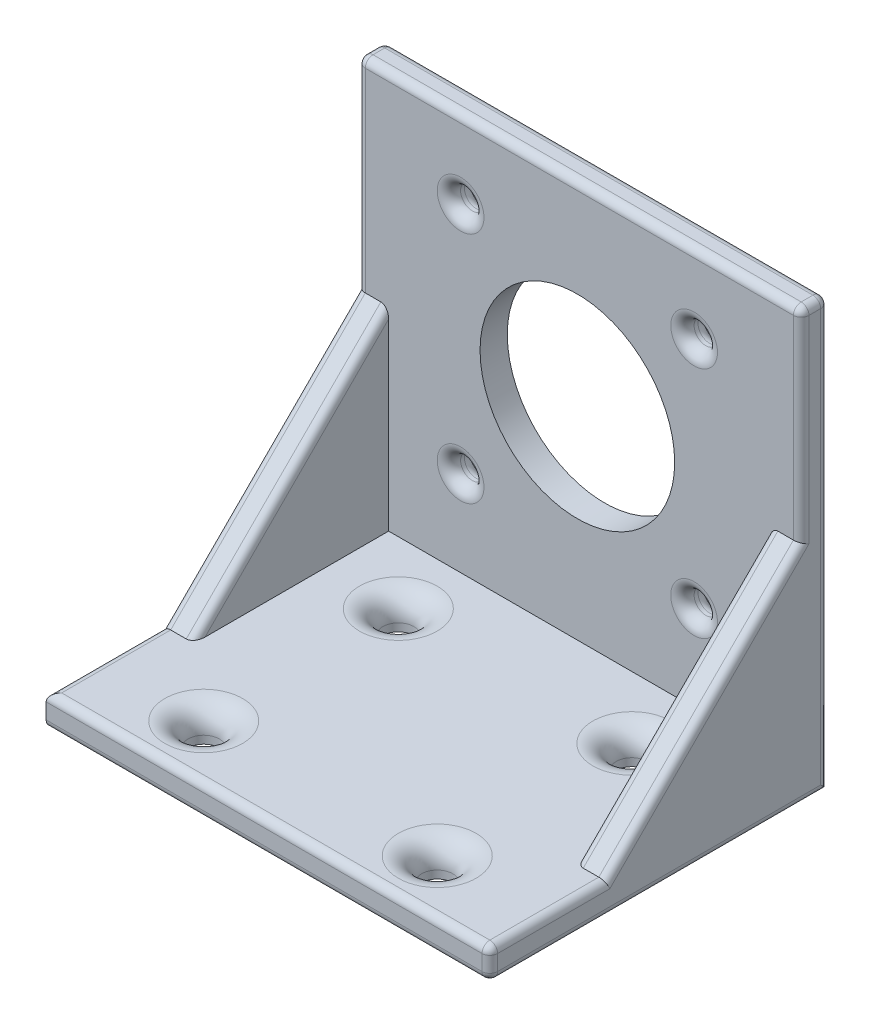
SolidWorks part; units mm, degrees
ref_plane "Front Plane" through (0, 0, 0) normal (0, 0, 1) x (1, 0, 0)
ref_plane "Top Plane" through (0, 0, 0) normal (0, 1, 0) x (1, 0, 0)
ref_plane "Right Plane" through (0, 0, 0) normal (1, 0, 0) x (0, 0, -1)
sketch "Sketch7" plane through (0, 0, 0) normal (0, 0, 1) x (1, 0, 0)
  line L1 (-65.2691, 9.1691) -> (-8.2691, 9.1691)
  line L2 (-65.2691, 9.1691) -> (-65.2691, -45.8309)
  line L3 (-65.2691, -45.8309) -> (-8.2691, -45.8309)
  line L4 (-8.2691, 9.1691) -> (-8.2691, -45.8309)
  circle A0 centre (-37.0244, -15.8309) radius 12.5
  circle A1 centre (-22.0244, -0.8309) radius 1.5
  circle A2 centre (-52.0244, -0.8309) radius 1.5
  circle A3 centre (-22.0244, -30.8309) radius 1.5
  circle A4 centre (-52.0244, -30.8309) radius 1.5
  point P4 (0, 0)
  point P5 (0, 0)
  point P16 (0, 0)
  point P17 (0, 0)
  point P18 (-54.1898, -3.4683)
  point P19 (0, 0)
  point P20 (0, 0)
  point P21 (0, 0)
  point P22 (-22.0244, 0.6691)
  point P23 (0, 0)
  point P24 (0, 0)
  point P25 (0, 0)
  dimension "D3" = 15
  dimension "D6" = 15
  dimension "D7" = 15
  dimension "D8" = 30
  dimension "D9" = 30
  dimension "D10" = 30
  dimension "D11" = 15
  dimension "D1" = 15
  dimension "D2" = 57
  dimension "D4" = 30
  dimension "D5" = 30
  dimension "D12" = 15
  dimension "D13" = 55
extrude "Boss-Extrude5" add sketch "Sketch7" along normal blind 3.5
sketch "Sketch8" plane through (-8.2691, 0, 0) normal (1, 0, 0) x (0, 0, -1)
  line L1 (-3.5, -45.8309) -> (-43.5, -45.8309)
  line L2 (-3.5, -45.8309) -> (-3.5, -41.8309)
  line L3 (-3.5, -41.8309) -> (-43.5, -41.8309)
  line L4 (-43.5, -45.8309) -> (-43.5, -41.8309)
  dimension "D1" = 40
  dimension "D2" = 4
extrude "Boss-Extrude6" add sketch "Sketch8" against normal blind 57
sketch "Sketch9" plane through (-8.2691, 0, 0) normal (1, 0, 0) x (0, 0, -1)
  line L0 (-3.5, -41.8309) -> (-3.5, -16.8309)
  line L2 (-3.5, -41.8309) -> (-3.5, 9.1691) construction
  line L3 (-3.5, -41.8309) -> (-28.5, -41.8309)
  line L4 (-3.5, -41.8309) -> (-43.5, -41.8309) construction
  line L5 (-28.5, -41.8309) -> (-3.5, -16.8309)
  dimension "D1" = 25
  dimension "D2" = 25
extrude "Boss-Extrude7" add sketch "Sketch9" against normal blind 4
sketch "Sketch11" plane through (-65.2691, 0, 0) normal (-1, 0, 0) x (0, 0, 1)
  line L0 (3.5, -16.8309) -> (3.5, -41.8309)
  line L1 (3.5, 9.1691) -> (3.5, -41.8309) construction
  line L2 (3.5, -41.8309) -> (28.5, -41.8309)
  line L3 (28.5, -41.8309) -> (3.5, -16.8309)
  dimension "D1" = 25
  dimension "D2" = 25
extrude "Boss-Extrude8" add sketch "Sketch11" against normal blind 4
sketch "Sketch12" plane through (0, -41.8309, 0) normal (0, 1, 0) x (1, 0, 0)
  line L0 (-36.7691, -43.5) -> (-36.7691, -3.5) construction
  line L1 (-65.2691, -43.5) -> (-8.2691, -43.5) construction
  line L2 (-61.2691, -3.5) -> (-12.2691, -3.5) construction
  circle A0 centre (-52.0244, -36.5) radius 2
  circle A1 centre (-22.0244, -36.5) radius 2
  circle A2 centre (-52.0244, -11.5) radius 2
  circle A3 centre (-22.0244, -11.5) radius 2
  dimension "D3" = 4
  dimension "D4" = 4
  dimension "D5" = 4
  dimension "D6" = 4
  dimension "D1" = 30
  dimension "D2" = 25
extrude "Cut-Extrude4" cut sketch "Sketch12" against normal blind 14
fillet "Fillet1" radius 1 1 edges at (-36.7691, 9.1691, 3.5)
fillet "Fillet2" radius 1 3 edges at (-65.2691, -4.3309, 3.5) (-65.2691, 8.8762, 3.2071) (-65.2691, 9.1691, 1.25)
fillet "Fillet3" radius 1 11 edges at (-8.2691, -4.3309, 3.5) (-8.2691, 8.8762, 3.2071) (-65.2691, -18.8309, 0) (-64.9763, 8.8762, 0) (-8.2691, -43.8309, 43.5) (-8.2691, -45.8309, 21.75) (-8.2691, -41.8309, 36) (-8.2691, -29.3309, 16) (-8.2691, -18.3309, 0) (-8.2691, 9.1691, 1.25) (-36.2691, 9.1691, 0)
fillet "Fillet4" radius 1 7 edges at (-8.562, -45.5381, 43.2071) (-8.562, -42.1238, 43.2071) (-37.2691, -45.8309, 43.5) (-65.2691, -41.8309, 36) (-65.2691, -28.8309, 15.5) (-61.2691, -29.3309, 16) (-37.2691, -41.8309, 43.5)
fillet "Fillet5" radius 1 1 edges at (-12.2691, -29.3309, 16)
fillet "Fillet6" radius 1.5 1 edges at (-50.5244, -0.8309, 3.5)
fillet "Fillet7" radius 1.5 1 edges at (-50.5244, -0.8309, 0)
fillet "Fillet8" radius 1.5 1 edges at (-20.5244, -0.8309, 3.5)
fillet "Fillet9" radius 1.5 1 edges at (-20.5244, -0.8309, 0)
fillet "Fillet10" radius 1.5 1 edges at (-20.5244, -30.8309, 0)
fillet "Fillet11" radius 1.5 1 edges at (-50.5244, -30.8309, 0)
fillet "Fillet12" radius 1.5 1 edges at (-50.5244, -30.8309, 3.5)
fillet "Fillet13" radius 1.5 1 edges at (-20.5244, -30.8309, 3.5)
fillet "Fillet15" radius 3 1 edges at (-22.0244, -41.8309, 13.5)
fillet "Fillet16" radius 3 2 edges at (-52.0244, -41.8309, 38.5) (-22.0244, -41.8309, 38.5)
fillet "Fillet17" radius 3 1 edges at (-52.0244, -41.8309, 13.5)
equation "\"f\"=1.5"
